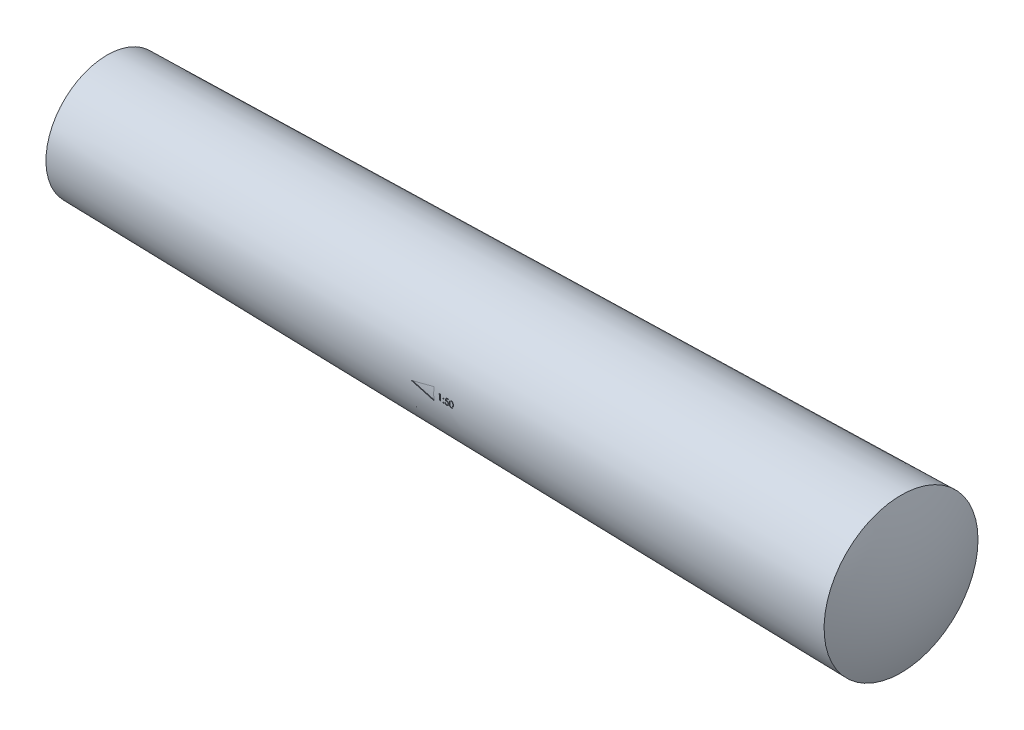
SolidWorks part; units mm, degrees
ref_plane "Front Plane" through (0, 0, 0) normal (0, 0, 1) x (1, 0, 0)
ref_plane "Top Plane" through (0, 0, 0) normal (0, 1, 0) x (1, 0, 0)
ref_plane "Right Plane" through (0, 0, 0) normal (1, 0, 0) x (0, 0, -1)
sketch "Sketch1" plane through (0, 0, 0) normal (1, 0, 0) x (0, 0, -1)
  circle A0 centre (0, 0) radius 10
  dimension "D1" = 20
extrude "Extrude1" add sketch "Sketch1" along normal mid plane 130
draft "Draft1" type of draft neutral plane draft angle 1.146 faces to draft 1 parameters "D1"=1.146
sketch "Sketch2" plane through (0, 0, 0) normal (0, 0, 1) x (1, 0, 0)
  line L0 (-65, 0) -> (-65, 10)
  line L1 (-65, 10) -> (-65, -10) construction
  line L2 (-65, 0) -> (-67.5, 0)
  line L3 (-67.5, 0) -> (-67.5, -11.3) construction
  line L4 (65, 0) -> (65, 12.6001)
  line L5 (65, -12.6001) -> (65, 12.6001) construction
  line L6 (65, 0) -> (67.5, 0)
  line L7 (67.5, 0) -> (67.5, -11.3) construction
  line L8 (-65, -10) -> (65, -12.6001) construction
  arc A0 (-67.5, 0) -> (-65, 10) centre (-46.25, 0) cw
  arc A1 (67.5, 0) -> (65, 12.6001) centre (34.4976, 0) ccw
  point P14 (0, -11.3)
revolve "Revolve1" add sketch "Sketch2" angle 360 about L2
sketch "Sketch5" plane through (0, 0, 0) normal (0, 0, 1) x (1, 0, 0)
  line L0 (0, 11.3) -> (0, -11.3) construction
  line L1 (65, 12.6001) -> (-65, 10) construction
  line L2 (-65, -10) -> (65, -12.6001) construction
ref_plane "Plane2" through (0, 0, 0) normal (-0.02, 0, 0.9998) x (0.9998, 0, 0.02)
sketch "Sketch6" plane through (0, 0, 0) normal (-0.02, 0, 0.9998) x (0.9998, 0, 0.02)
  line L0 (0, 0) -> (0, 1)
  line L1 (0, 11.3) -> (0, -11.3) construction
  line L2 (0, 1) -> (-3.7321, 0)
  line L3 (-3.7321, 0) -> (0, -1)
  line L4 (0, -1) -> (0, 0)
  line L5 (0, -0.5) -> (4, -0.5) construction
  text T0 "1:50" font "Century Gothic" height 1
  dimension "D1" = 2
  dimension "D2" = 30
  dimension "D3" = 4
wrap "Wrap2" sketch "Sketch6" wrap type deboss source sketch "Sketch6" thickness 0.1 parameters "D1"=0.1
equation "\"D2@Sketch2\" = \"D1@Sketch2\""
